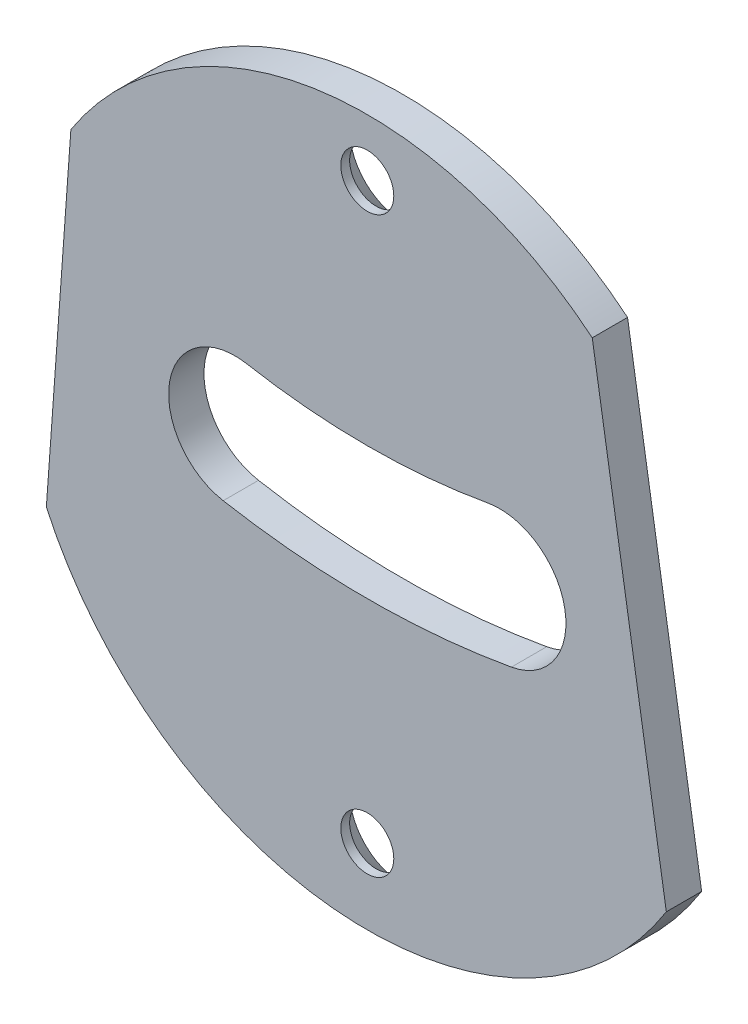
SolidWorks part; units mm, degrees
ref_plane "Face" through (0, 0, 0) normal (0, 0, 1) x (1, 0, 0)
ref_plane "Dessus" through (0, 0, 0) normal (0, 1, 0) x (1, 0, 0)
ref_plane "Droite" through (0, 0, 0) normal (1, 0, 0) x (0, 0, -1)
sketch "Esquisse1" plane through (0, 0, 0) normal (0, 0, 1) x (1, 0, 0)
  line L0 (-9, 13.5) -> (11, 13.5) construction
  line L1 (-9, -51.5) -> (11, -51.5) construction
  line L4 (-32.5751, 1.7419) -> (-35.3543, -36.6843)
  line L5 (1, 65) -> (-16.664, -33.525) construction
  line L6 (1, 65) -> (18.6231, -33.2971) construction
  line L7 (26.4805, 10.8341) -> (34.8717, -41.277)
  line L8 (21, 44.8697) -> (21.0364, 44.6434)
  circle A0 centre (1, 13.5) radius 3
  circle A1 centre (1, -51.5) radius 3
  arc A2 (26.4805, 10.8341) -> (-32.5751, 1.7419) centre (1, -20) ccw
  arc A3 (-14, -18.666) -> (16, -18.666) centre (1, 65) ccw construction
  arc A4 (-12.6765, -11.2837) -> (14.6765, -11.2837) centre (1, 65) ccw
  arc A5 (-15.3235, -26.0483) -> (17.3235, -26.0483) centre (1, 65) ccw
  arc A6 (17.3235, -26.0483) -> (14.6765, -11.2837) centre (16, -18.666) ccw
  arc A7 (-12.6765, -11.2837) -> (-15.3235, -26.0483) centre (-14, -18.666) ccw
  arc A9 (-35.3543, -36.6843) -> (34.8717, -41.277) centre (1, -20) ccw
  dimension "D1" = 6
  dimension "D2" = 15
  dimension "D3" = 80
  dimension "D4" = 6
extrude "Extrusion1" add sketch "Esquisse1" along normal blind 4
chamfer "Chanfrein2" distance 3 angle 45 2 edges at (4, -51.5, 0) (4, 13.5, 0)
